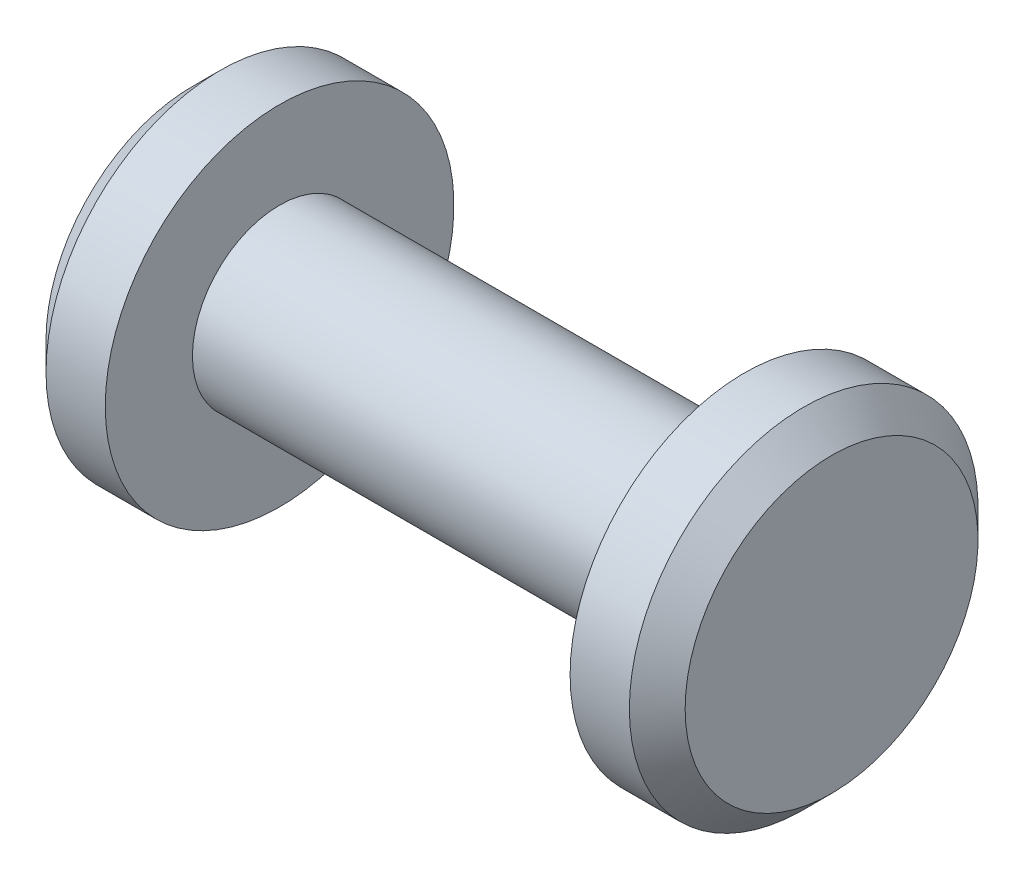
SolidWorks part; units mm, degrees
ref_plane "front" through (0, 0, 0) normal (0, 0, 1) x (1, 0, 0)
ref_plane "top" through (0, 0, 0) normal (0, 1, 0) x (1, 0, 0)
ref_plane "side" through (0, 0, 0) normal (1, 0, 0) x (0, 0, -1)
sketch "Sketch1" plane through (0, 0, 0) normal (0, 0, 1) x (1, 0, 0)
  line L0 (0, 0) -> (55.8636, 0) construction
  line L1 (8.7312, 0) -> (8.7312, 4.7625)
  line L2 (8.7312, 4.7625) -> (6.35, 4.7625)
  line L3 (6.35, 4.7625) -> (6.35, 2.3813)
  line L4 (6.35, 2.3813) -> (-6.35, 2.3812)
  line L5 (0, 0) -> (0, 55.2608) construction
  line L6 (-8.7312, 0) -> (8.7312, 0)
  line L7 (-6.35, 4.7625) -> (-6.35, 2.3812)
  line L8 (-8.7312, 4.7625) -> (-6.35, 4.7625)
  line L9 (-8.7312, 0) -> (-8.7312, 4.7625)
  point P12 (8.7312, -4.7625)
  point P13 (6.35, 2.3813)
  point P14 (6.35, -2.3812)
  dimension "D1" = 12.7
  dimension "D2" = 17.4625
  dimension "D3" = 4.7625
  dimension "D4" = 9.525
revolve "Base-Revolve" add sketch "Sketch1" angle 360 about L0
chamfer "Chamfer1" distance 0.762 angle 45 2 edges at (8.7312, 0, 4.7625) (-8.7312, 0, 4.7625)
